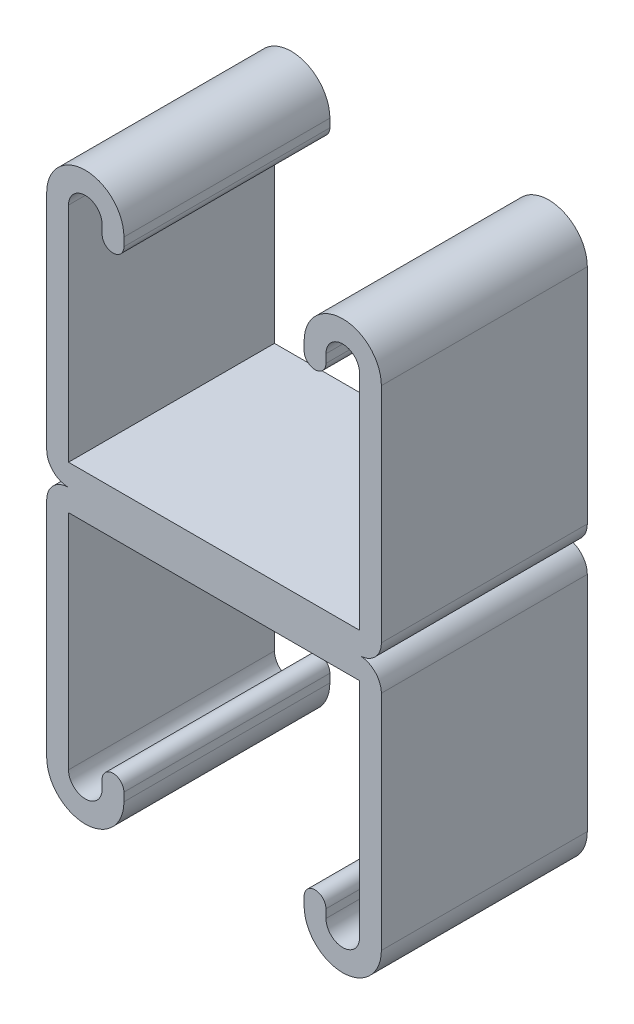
SolidWorks part; units mm, degrees
ref_plane "Plane1" through (0, 0, 0) normal (0, 0, 1) x (1, 0, 0)
ref_plane "Plane2" through (0, 0, 0) normal (0, 1, 0) x (1, 0, 0)
ref_plane "Plane3" through (0, 0, 0) normal (1, 0, 0) x (0, 0, -1)
sketch "Sketch1" plane through (0, 0, 0) normal (0, 0, 1) x (1, 0, 0)
  line L0 (-20.6375, 30.1625) -> (-20.6375, 2.6924)
  line L1 (-17.9451, 0) -> (17.9451, 0)
  line L2 (20.6375, 2.6924) -> (20.6375, 30.1625)
  line L3 (11.1125, 30.1625) -> (11.1125, 29.1274)
  line L4 (-11.1125, 30.1625) -> (-11.1125, 29.1274)
  line L5 (-13.8049, 30.1625) -> (-13.8049, 29.1274)
  line L6 (-17.9451, 30.1625) -> (-17.9451, 2.6924)
  line L7 (-17.9451, 2.6924) -> (17.9451, 2.6924)
  line L8 (17.9451, 2.6924) -> (17.9451, 30.1625)
  line L9 (13.8049, 30.1625) -> (13.8049, 29.1274)
  line L10 (-25.4, 34.925) -> (25.4, 34.925) construction
  line L11 (-12.8524, 27.7812) -> (12.8524, 27.7812) construction
  arc A0 (20.6375, 30.1625) -> (11.1125, 30.1625) centre (15.875, 30.1625) ccw
  arc A1 (-20.6375, 30.1625) -> (-11.1125, 30.1625) centre (-15.875, 30.1625) cw
  arc A2 (-17.9451, 0) -> (-20.6375, 2.6924) centre (-17.9451, 2.6924) cw
  arc A3 (17.9451, 0) -> (20.6375, 2.6924) centre (17.9451, 2.6924) ccw
  arc A4 (-17.9451, 30.1625) -> (-13.8049, 30.1625) centre (-15.875, 30.1625) cw
  arc A5 (17.9451, 30.1625) -> (13.8049, 30.1625) centre (15.875, 30.1625) ccw
  arc A6 (11.1125, 29.1274) -> (13.8049, 29.1274) centre (12.4587, 29.1274) ccw
  arc A7 (-11.1125, 29.1274) -> (-13.8049, 29.1274) centre (-12.4587, 29.1274) cw
  dimension "D1" = 2.6924
  dimension "Width" = 41.275
  dimension "D6" = 9.525
  dimension "D7" = 22.225
  dimension "D9" = 7.1437
  dimension "D2" = 34.925
  dimension "gauge" = 2.6924
extrude "Base-Extrude" add sketch "Sketch1" along normal mid plane 25.4
mirror "Mirror1" about plane through (0, 0, 0) normal (0, 1, 0) of "Base-Extrude"
equation "\"D7@Sketch1\" = \"Width@Sketch1\" - 2 * \"D6@Sketch1\""
equation "\"D1@Sketch1\" = \"gauge@Sketch1\""
